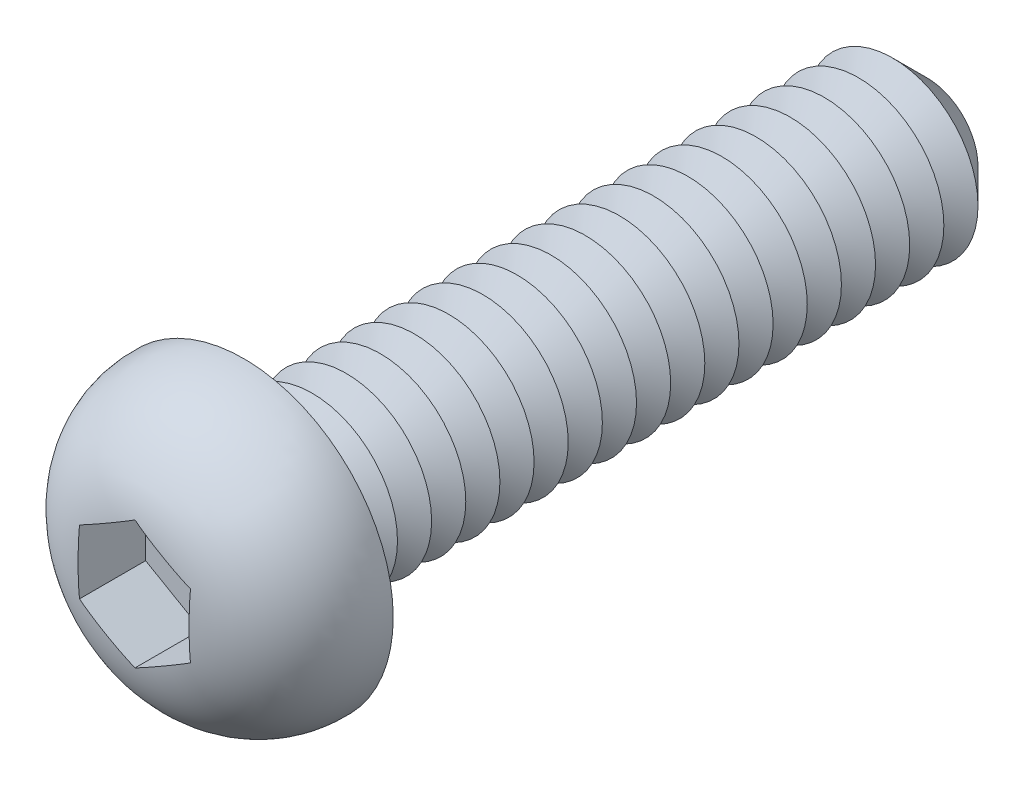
SolidWorks part; units mm, degrees
ref_plane "Front Plane" through (0, 0, 0) normal (0, 0, 1) x (1, 0, 0)
ref_plane "Top Plane" through (0, 0, 0) normal (0, 1, 0) x (1, 0, 0)
ref_plane "Right Plane" through (0, 0, 0) normal (1, 0, 0) x (0, 0, -1)
sketch "Sketch1" plane through (0, 0, 0) normal (1, 0, 0) x (0, 0, -1)
  line L0 (-47.9342, 0) -> (60.3146, 0) construction
sketch "Sketch2" plane through (0, 0, 0) normal (1, 0, 0) x (0, 0, -1)
  line L0 (0, 0) -> (-1.3, 0)
  line L1 (-47.9342, 0) -> (60.3146, 0) construction
  line L2 (-1.3, 0) -> (-1.3, 0.501)
  line L3 (0, 1.75) -> (0, 0)
  arc A0 (-1.3, 0.501) -> (0, 1.75) centre (-0.05, 0.501) cw
  dimension "D1" = 1.25
  dimension "D2" = 1.3
  dimension "D3" = 1.75
revolve "Revolve1" add sketch "Sketch2" angle 360 about L0
sketch "Sketch3" plane through (0, 0, 1.3) normal (0, 0, 1) x (1, 0, 0)
  line L1 (0, 0.7506) -> (-0.65, 0.3753)
  line L2 (-0.65, 0.3753) -> (-0.65, -0.3753)
  line L3 (-0.65, -0.3753) -> (0, -0.7506)
  line L4 (0, -0.7506) -> (0.65, -0.3753)
  line L5 (0.65, -0.3753) -> (0.65, 0.3753)
  line L6 (0.65, 0.3753) -> (0, 0.7506)
  circle A0 centre (0, 0) radius 0.65 construction
  dimension "D1" = 1.3
extrude "Cut-Extrude1" cut sketch "Sketch3" against normal blind 0.8
sketch "Sketch4" plane through (0, 0, 0) normal (0, 0, -1) x (-1, 0, 0)
  circle A0 centre (0, 0) radius 1
  dimension "D1" = 2
extrude "Boss-Extrude1" add sketch "Sketch4" along normal blind 8
chamfer "Chamfer1" distance 0.4 angle 45 1 edges at (-1, 0, -8)
sketch "Sketch5" plane through (0, 0, 0) normal (1, 0, 0) x (0, 0, -1)
  line L0 (0.4, 1) -> (0.8, 1)
  line L1 (7.6, 1) -> (0, 1) construction
  line L2 (0.8, 1) -> (0.6, 0.6536)
  line L3 (0.6, 0.6536) -> (0.4, 1)
  line L4 (0, -1.75) -> (0, 1.75) construction
  line L5 (7.6, 1) -> (0, 1) construction
  dimension "D1" = 0.4
  dimension "D2" = 0.4
revolve "Cut-Revolve1" cut sketch "Sketch5" angle 360 about L0
pattern_linear "LPattern1" count 18 spacing 0.4 along (0, 0, -1) of "Cut-Revolve1"
fillet "Fillet2" radius 0.2 1 edges at (-1, 0, 0)
sketch "Sketch6" plane through (0, 0, 0.5) normal (0, 0, 1) x (1, 0, 0)
  circle A0 centre (0, 0) radius 0.35
  dimension "D1" = 0.7
extrude "Cut-Extrude2" cut sketch "Sketch6" against normal up to surface (8.5 mm away)
